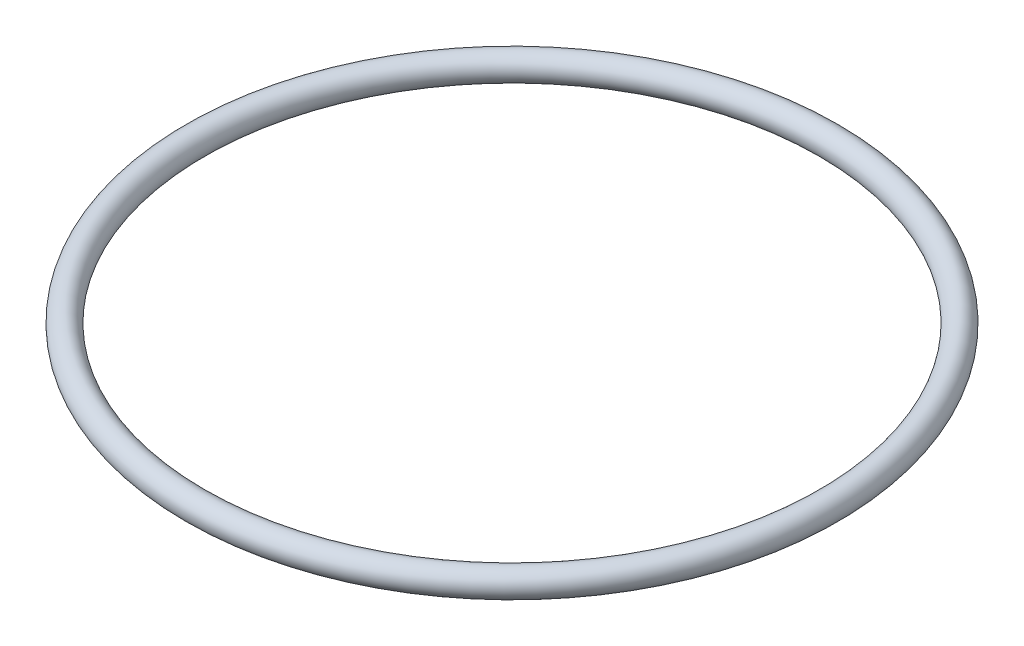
SolidWorks part; units mm, degrees
ref_plane "Face" through (0, 0, 0) normal (0, 0, 1) x (1, 0, 0)
ref_plane "Dessus" through (0, 0, 0) normal (0, 1, 0) x (1, 0, 0)
ref_plane "Côté" through (0, 0, 0) normal (1, 0, 0) x (0, 0, -1)
sketch "Esquisse1" plane through (0, 0, 0) normal (0, 0, 1) x (1, 0, 0)
  line L0 (0, 0) -> (0, 15.7513) construction
  line L1 (0, 0) -> (-8.3073, 0) construction
  circle A0 centre (-64.565, 2.665) radius 2.665
  dimension "D1" = 5.33
  dimension "D2" = 123.8
revolve "Base-Révolution" add sketch "Esquisse1" angle 360 about L0
sketch "Esquisse3" [suppressed] plane through (0, 0, 0) normal (0, 1, 0) x (1, 0, 0)
  circle A0 centre (0, 0) radius 68.9
  dimension "D1" = 137.8
extrude "Tronquage" [suppressed] cut sketch "Esquisse3" along normal blind 33.7 flip side to cut
